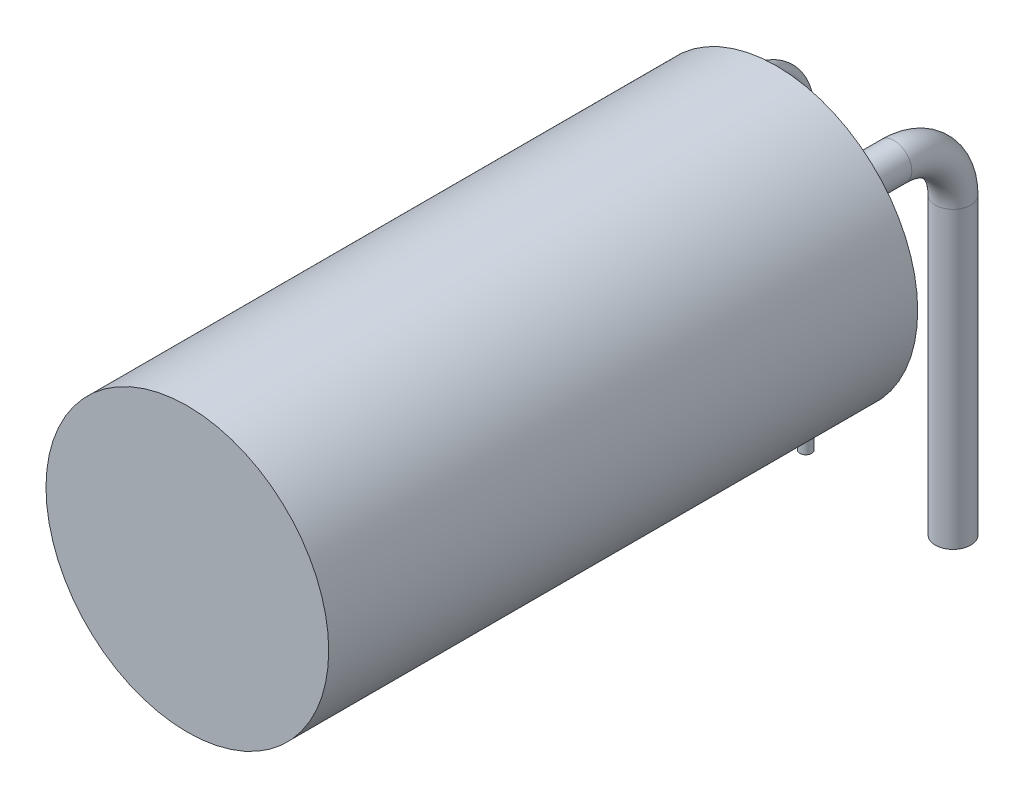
SolidWorks part; units mm, degrees
ref_plane "Plan de face" through (0, 0, 0) normal (0, 0, 1) x (1, 0, 0)
ref_plane "Plan de dessus" through (0, 0, 0) normal (0, 1, 0) x (1, 0, 0)
ref_plane "Plan de droite" through (0, 0, 0) normal (1, 0, 0) x (0, 0, -1)
sketch "Esquisse1" plane through (0, 0, 0) normal (0, 0, 1) x (1, 0, 0)
  circle A0 centre (0, 0) radius 2.4
extrude "Extrusion1" add sketch "Esquisse1" along normal blind 10
ref_plane "Plan1" through (0, 0, 0) normal (1, 0, 0) x (0, 0, -1)
sketch "Esquisse2" plane through (0, 0, 0) normal (1, 0, 0) x (0, 0, -1)
  line L0 (0, -3.0292) -> (0, 3.4753) construction
  line L1 (3, -6.3389) -> (3, 4.7992) construction
  line L2 (-2.0952, 0) -> (6.136, 0) construction
  line L3 (6.136, -6) -> (-2.0952, -6) construction
  line L4 (0, 0) -> (2, 0)
  line L5 (3, -1) -> (3, -6)
  arc A0 (2, 0) -> (3, -1) centre (2, -1) cw
  dimension "D3" = 1
  dimension "D1" = 3
  dimension "D2" = 6
sketch "Esquisse3" plane through (0, 0, 0) normal (0, 0, -1) x (-1, 0, 0)
  circle A0 centre (0, 0) radius 0.3
sweep "Balayage1" add profiles "Esquisse3" path "Esquisse2"
ref_plane "Plan2" through (-2.5, 0, 0) normal (1, 0, 0) x (0, 0, -1)
sketch "Esquisse4" plane through (-2.5, 0, 0) normal (1, 0, 0) x (0, 0, -1)
  line L0 (-2.9815, 0) -> (4.6369, 0) construction
  line L1 (0, -3.9042) -> (0, 5.0211) construction
  line L2 (3, 4.2083) -> (3, -6.3428) construction
  line L3 (0.1105, -6) -> (4.5254, -6) construction
  line L4 (-0.5, 4.8601) -> (-0.5, -3.9042) construction
  line L5 (-0.5, 0) -> (2, 0)
  line L6 (3, -1) -> (3, -6)
  arc A0 (2, 0) -> (3, -1) centre (2, -1) cw
  dimension "D4" = 1
  dimension "D1" = 3
  dimension "D2" = 6
  dimension "D3" = 0.5
ref_plane "Plan3" through (0, 0, 0.5) normal (0, 0, 1) x (1, 0, 0)
sketch "Esquisse5" plane through (0, 0, 0.5) normal (0, 0, 1) x (1, 0, 0)
  line L0 (0.8447, 0) -> (-3.069, 0) construction
  circle A0 centre (-2.5, 0) radius 0.101
sweep "Balayage2" add profiles "Esquisse5" path "Esquisse4"
